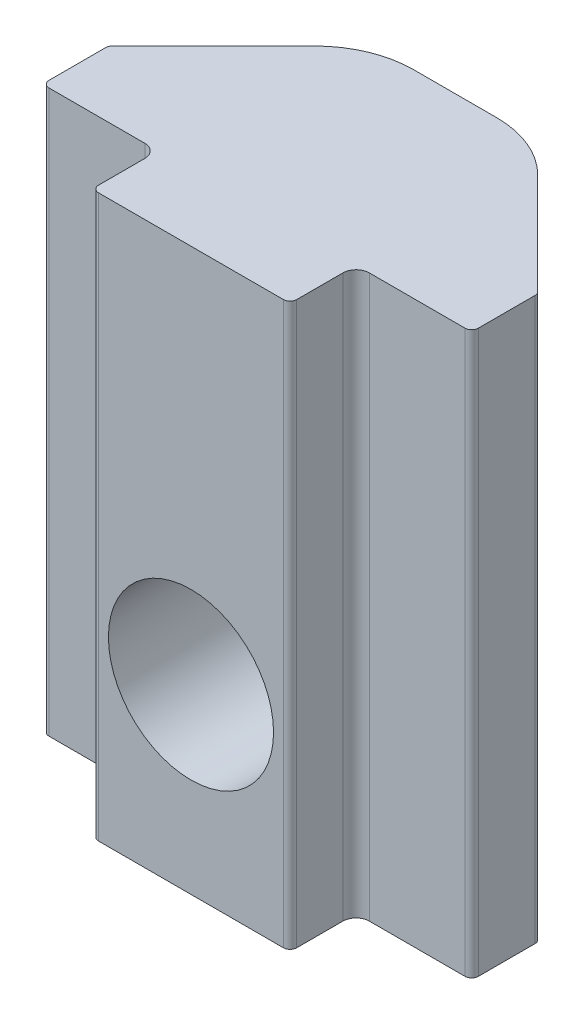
SolidWorks part; units mm, degrees
ref_plane "Front Plane" through (0, 0, 0) normal (0, 0, 1) x (1, 0, 0)
ref_plane "Top Plane" through (0, 0, 0) normal (0, 1, 0) x (1, 0, 0)
ref_plane "Right Plane" through (0, 0, 0) normal (1, 0, 0) x (0, 0, -1)
imported_body "item_0043429_Groove_Profile_6_Al_L=2000_3.stp"
sketch "Sketch1" plane through (0, 0, 0) normal (0, 0, 1) x (1, 0, 0)
  line L1 (-6.5, 1000) -> (6.5, 1000)
  line L2 (-6.5, 1000) -> (-6.5, -983)
  line L3 (-6.5, -983) -> (6.5, -983)
  line L4 (6.5, 1000) -> (6.5, -983)
  line L5 (6.5, 1000) -> (6.5, -1000) construction
  dimension "D1" = 1983
extrude "Cut-Extrude1" cut sketch "Sketch1" against normal through all both and the other way through all
sketch "Sketch2" plane through (0, 0, 2) normal (0, 0, 1) x (1, 0, 0)
  line L0 (-2.8, -1000) -> (2.8, -1000) construction
  circle A0 centre (0, -994.5) radius 2.5
  dimension "D1" = 5
  dimension "D2" = 5.5
extrude "Cut-Extrude5" cut sketch "Sketch2" against normal through all
